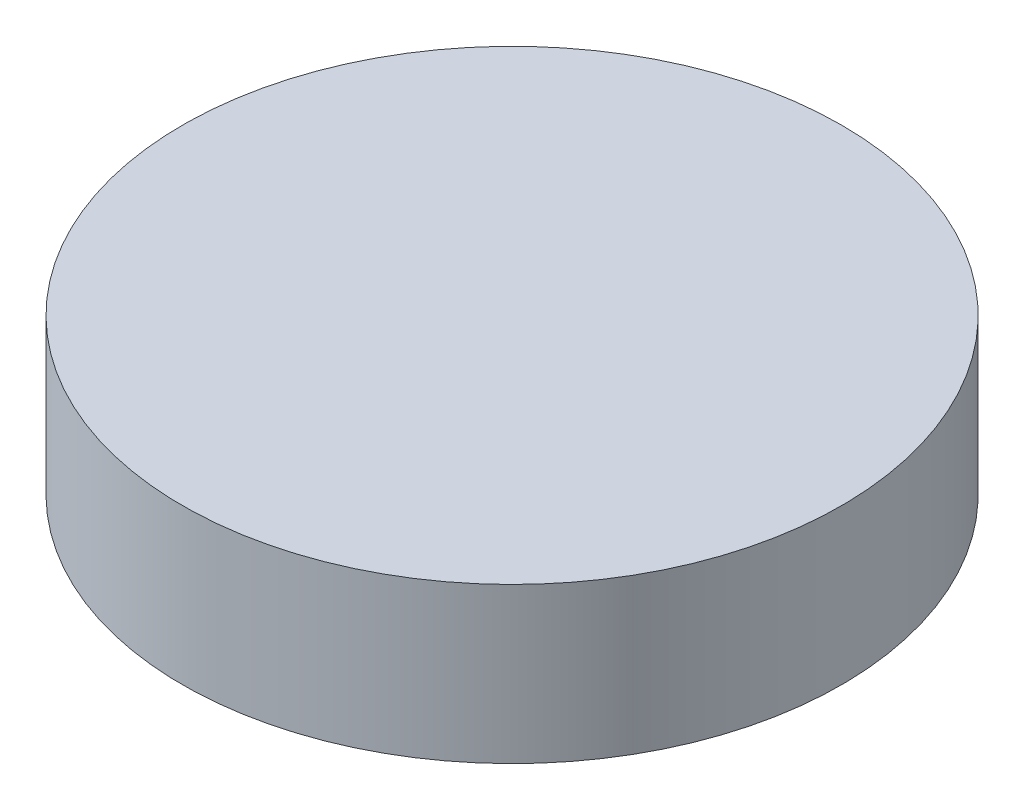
SolidWorks part; units mm, degrees
ref_plane "前视基准面" through (0, 0, 0) normal (0, 0, 1) x (1, 0, 0)
ref_plane "上视基准面" through (0, 0, 0) normal (0, 1, 0) x (1, 0, 0)
ref_plane "右视基准面" through (0, 0, 0) normal (1, 0, 0) x (0, 0, -1)
sketch "草图1" plane through (0, 0, 0) normal (0, 0, 1) x (1, 0, 0)
  line L0 (0, 0) -> (0, 1091.2106) construction
  line L1 (0, 378) -> (-565, 378)
  line L2 (-565, 378) -> (-565, 112)
  line L3 (-565, 112) -> (-360, 0)
  line L4 (-360, 0) -> (0, 0)
  line L5 (0, 0) -> (0, 378)
  dimension "D1" = 1130
  dimension "D2" = 720
  dimension "D3" = 266
  dimension "D4" = 378
revolve "旋转1" add sketch "草图1" angle 360 about L0
